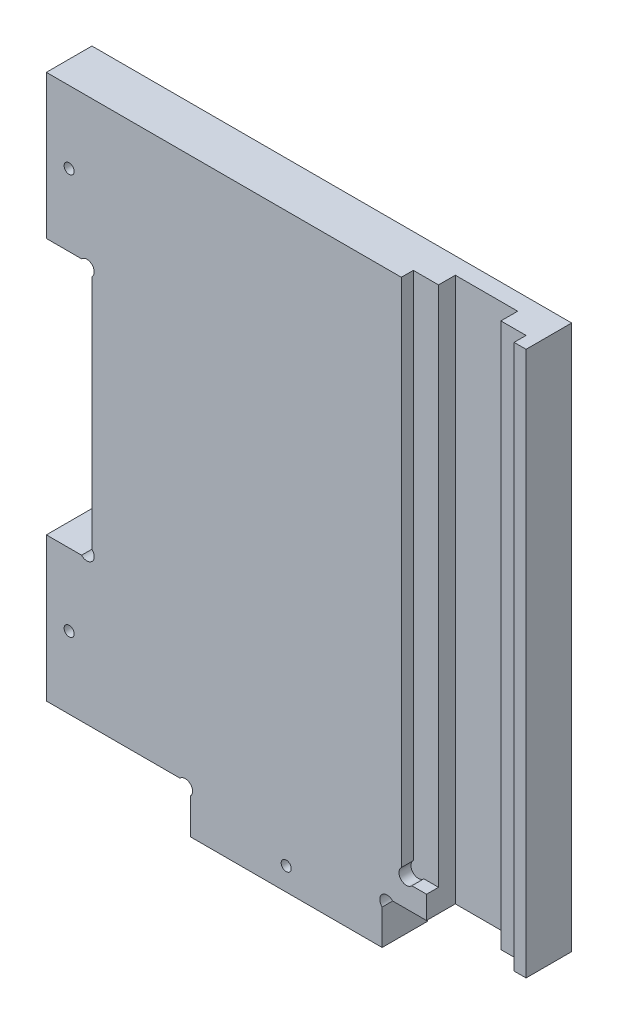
SolidWorks part; units mm, degrees
ref_plane "Plan de face" through (0, 0, 0) normal (0, 0, 1) x (1, 0, 0)
ref_plane "Plan de dessus" through (0, 0, 0) normal (0, 1, 0) x (1, 0, 0)
ref_plane "Plan de droite" through (0, 0, 0) normal (1, 0, 0) x (0, 0, -1)
sketch "Esquisse1" plane through (0, 0, 0) normal (0, 0, 1) x (1, 0, 0)
  line L0 (140, 85.1266) -> (140, 3.8504) construction
  line L1 (0, 0) -> (161.5047, 0) construction
  line L2 (0, 19) -> (0, 79)
  line L3 (0, 246) -> (200, 246)
  line L4 (200, 19) -> (200, 246)
  line L5 (-11.7926, 19) -> (221.8419, 19) construction
  line L6 (60, 75.0962) -> (60, 6.6411) construction
  line L7 (-14.8322, 79) -> (26.3087, 79) construction
  line L8 (-14.8322, 186) -> (35.204, 186) construction
  line L9 (19, 215.6811) -> (19, 65.5726) construction
  line L10 (0, 186) -> (14.6881, 186)
  line L11 (19, 181.6881) -> (19, 83.3119)
  line L12 (14.6881, 79) -> (0, 79)
  line L13 (60, 0) -> (60, 14.6881)
  line L14 (55.6881, 19) -> (0, 19)
  line L15 (60, 0) -> (140, 0)
  line L16 (0, 186) -> (0, 246)
  line L17 (140, 0) -> (140, 14.6196)
  line L18 (144.3804, 19) -> (200, 19)
  line L19 (355.3646, 314.5652) -> (355.3646, -131.8686) construction
  line L32 (100, 0) -> (100, 46.5726) construction
  line L33 (19, 132.5) -> (60, 132.5) construction
  arc A0 (144.3804, 19) -> (140, 14.6196) centre (142.1, 16.9) ccw
  arc A1 (60, 14.6881) -> (55.6881, 19) centre (57.9, 16.9) ccw
  arc A2 (14.6881, 79) -> (19, 83.3119) centre (16.9, 81.1) ccw
  arc A3 (19, 181.6881) -> (14.6881, 186) centre (16.9, 183.9) ccw
  circle A8 centre (100, 9.5) radius 2.1
  circle A9 centre (9.5, 49) radius 2.1
  circle A10 centre (9.5, 216) radius 2.1
  dimension "D9" = 2.1
  dimension "D7" = 2.1
  dimension "D12" = 9.5
  dimension "D18" = 9.5
  dimension "D1" = 246
  dimension "D2" = 200
  dimension "D3" = 60
  dimension "D4" = 60
  dimension "D5" = 79
  dimension "D6" = 60
  dimension "D8" = 19
  dimension "D10" = 2.1
  dimension "D11" = 2.1
  dimension "D13" = 2.1
  dimension "D14" = 2.1
  dimension "D15" = 2.1
  dimension "D16" = 2.1
  dimension "D17" = 19
  dimension "D19" = 30
extrude "Boss.-Extru.1" add sketch "Esquisse1" along normal blind 19
sketch "Esquisse3" plane through (0, 0, 19) normal (0, 0, 1) x (1, 0, 0)
  line L0 (184.5, 260.0988) -> (184.5, -17.1649) construction
  line L1 (158.5, 260.0988) -> (158.5, -3.1484) construction
  line L2 (200, 19) -> (200, 246) construction
  line L4 (158.5, 251.7765) -> (184.5, 251.7765)
  line L5 (158.5, 251.7765) -> (158.5, 12.1821)
  line L6 (158.5, 12.1821) -> (184.5, 12.1821)
  line L7 (184.5, 251.7765) -> (184.5, 12.1821)
  dimension "D1" = 15.5
  dimension "D2" = 26
extrude "Enlèv. mat.-Extru.1" cut sketch "Esquisse3" against normal blind 12
sketch "Esquisse4" plane through (0, 0, 19) normal (0, 0, 1) x (1, 0, 0)
  line L0 (158.5, 246) -> (158.5, 19) construction
  line L1 (148, 269.0909) -> (148, -9.564) construction
  line L2 (195, 262.6149) -> (195, -9.564) construction
  line L3 (148, 256.9167) -> (161.7579, 256.9167)
  line L4 (148, 256.9167) -> (148, 32.8804)
  line L5 (152.3804, 28.5) -> (161.7579, 28.5)
  line L6 (161.7579, 256.9167) -> (161.7579, 28.5)
  line L7 (138.5276, 28.5) -> (169.879, 28.5) construction
  line L8 (184.5, 19) -> (184.5, 246) construction
  line L9 (158.5, 19) -> (184.5, 19) construction
  line L10 (195, 256.9167) -> (178.0209, 256.9167)
  line L11 (195, 256.9167) -> (195, 9.3737)
  line L12 (195, 9.3737) -> (178.0209, 9.3737)
  line L13 (178.0209, 256.9167) -> (178.0209, 9.3737)
  arc A0 (148, 32.8804) -> (152.3804, 28.5) centre (150.1, 30.6) ccw
  dimension "D4" = 2.1
  dimension "D1" = 10.5
  dimension "D2" = 10.5
  dimension "D3" = 9.5
  dimension "D5" = 2.1
extrude "Enlèv. mat.-Extru.2" cut sketch "Esquisse4" against normal blind 5
sketch "Esquisse5" plane through (0, 0, 19) normal (0, 0, 1) x (1, 0, 0)
  text T0 "www.a4.fr" font "Arial Narrow" height 0.01
extrude "Enlèv. mat.-Extru.3" cut sketch "Esquisse5" against normal blind 0.01
